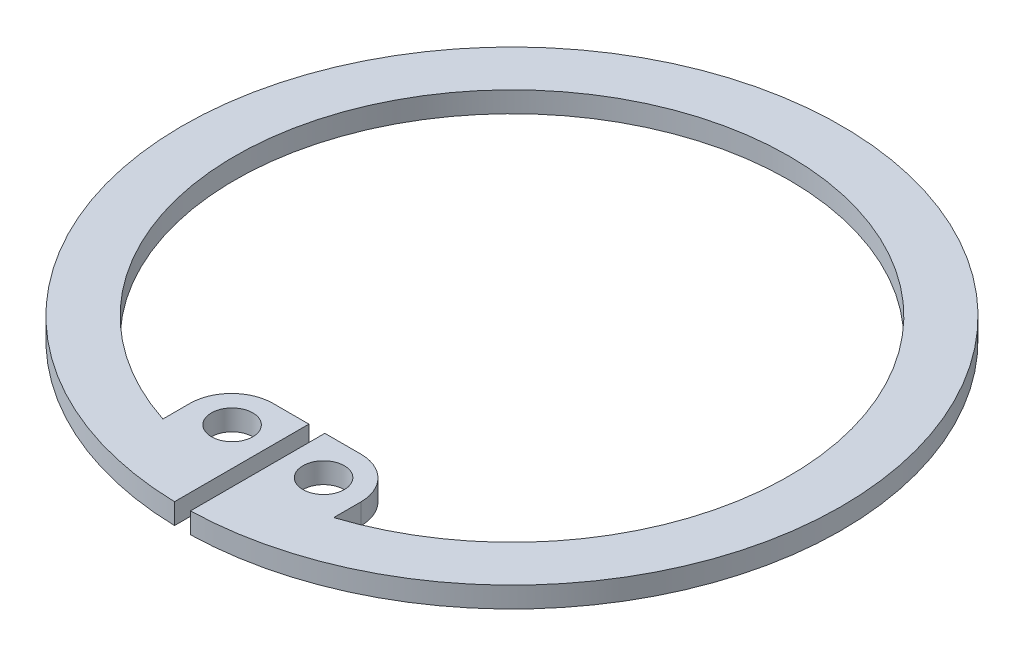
SolidWorks part; units mm, degrees
ref_plane "Plan de face" through (0, 0, 0) normal (0, 0, 1) x (1, 0, 0)
ref_plane "Plan de dessus" through (0, 0, 0) normal (0, 1, 0) x (1, 0, 0)
ref_plane "Plan de droite" through (0, 0, 0) normal (1, 0, 0) x (0, 0, -1)
sketch "Esquisse1" plane through (0, 0, 0) normal (0, 1, 0) x (1, 0, 0)
  line L0 (0, 72.325) -> (0, -82.8708) construction
  line L1 (-1.1552, -47.736) -> (-1.1552, -28.2649)
  line L2 (12.3715, -28.2649) -> (1.1552, -28.2649)
  line L3 (-12.3715, -38.1964) -> (-12.3715, -28.2649)
  line L4 (-12.3715, -28.2649) -> (-1.1552, -28.2649)
  line L5 (12.3715, -38.1964) -> (12.3715, -28.2649)
  line L6 (1.1552, -47.736) -> (1.1552, -28.2649)
  arc A0 (12.3715, -38.1964) -> (-12.3715, -38.1964) centre (0, 0) ccw
  arc A1 (1.1552, -47.736) -> (-1.1552, -47.736) centre (0, 0) ccw
  circle A2 centre (-6.6282, -33.9171) radius 3
  circle A3 centre (6.6282, -33.9171) radius 3
  dimension "D1" = 80.3
  dimension "D2" = 95.5
  dimension "D3" = 6
extrude "Extrusion2" add sketch "Esquisse1" along normal blind 3
fillet "Congé2" radius 6 2 edges at (12.3715, 1.5, 28.2649) (-12.3715, 1.5, 28.2649)
